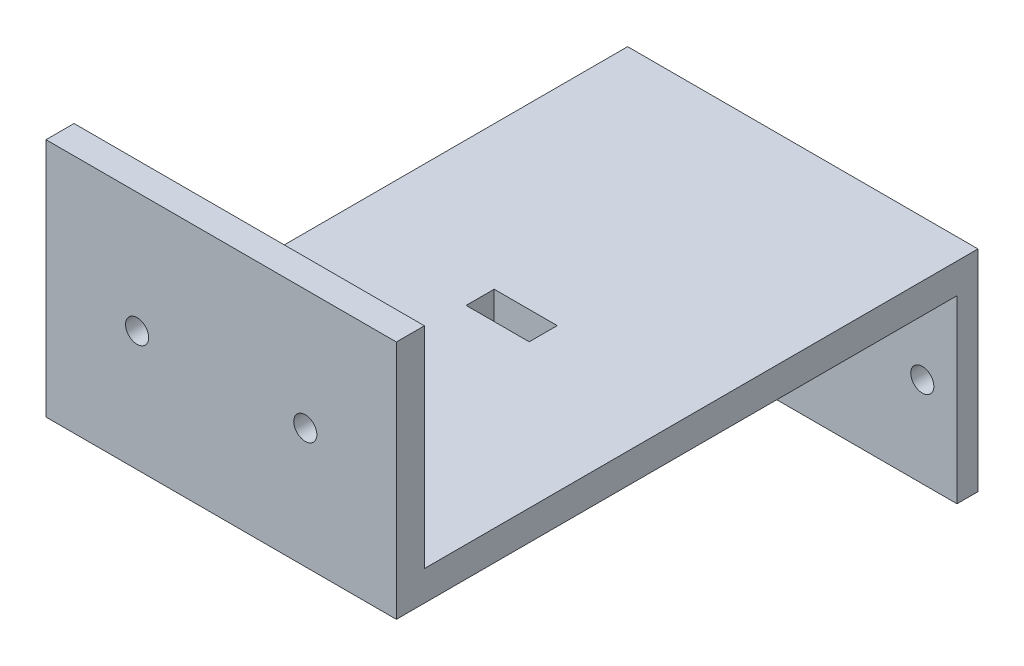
SolidWorks part; units mm, degrees
ref_plane "前视基准面" through (0, 0, 0) normal (0, 0, 1) x (1, 0, 0)
ref_plane "上视基准面" through (0, 0, 0) normal (0, 1, 0) x (1, 0, 0)
ref_plane "右视基准面" through (0, 0, 0) normal (1, 0, 0) x (0, 0, -1)
other "Configuration Table"
sketch "草图1" plane through (0, 0, 0) normal (0, 0, 1) x (1, 0, 0)
  line L0 (0, 0) -> (-50, 0)
  line L1 (-50, 0) -> (-50, 30)
  line L2 (-50, 30) -> (0, 30)
  line L3 (0, 30) -> (0, 0)
  dimension "D1" = 50
  dimension "D2" = 30
extrude "凸台-拉伸1" add sketch "草图1" along normal blind 3
sketch "草图3" plane through (0, 0, 3) normal (0, 0, 1) x (1, 0, 0)
  line L0 (-50, 30) -> (0, 30)
  line L1 (0, 30) -> (-50, 30) construction
  line L2 (-50, 30) -> (-50, 0) construction
  line L3 (0, 30) -> (0, 25.7173)
  line L4 (0, 0) -> (0, 30) construction
  line L5 (0, 25.7173) -> (-50, 25.7173)
  line L6 (-50, 25.7173) -> (-50, 30)
extrude "凸台-拉伸2" add sketch "草图3" along normal blind 80
sketch "草图6" plane through (0, 30, 0) normal (0, 1, 0) x (1, 0, 0)
  line L0 (-50, -83) -> (0, -83)
  line L1 (0, -83) -> (0, -79)
  line L2 (0, -83) -> (0, 0) construction
  line L3 (0, -79) -> (-50, -79)
  line L4 (-50, -83) -> (-50, 0) construction
  line L5 (-50, -79) -> (-50, -83)
  dimension "D1" = 4
extrude "凸台-拉伸3" add sketch "草图6" along normal blind 30
sketch "草图7" plane through (0, 0, 3) normal (0, 0, 1) x (1, 0, 0)
  line L0 (-50, 12.8587) -> (21.8234, 12.8587) construction
  line L1 (-50, 25.7173) -> (-50, 0) construction
  line L2 (-25, 0) -> (-25, 21.1552) construction
  line L3 (-50, 0) -> (0, 0) construction
  circle A0 centre (-45.05, 12.8587) radius 1.65
  circle A1 centre (-4.95, 12.8587) radius 1.65
  dimension "D1" = 40.1
  dimension "D2" = 3.3
extrude "切除-拉伸1" cut sketch "草图7" against normal blind 30
sketch "草图8" plane through (0, 0, 83) normal (0, 0, 1) x (1, 0, 0)
  line L0 (-50, 42.8587) -> (17.1704, 42.8587) construction
  line L2 (-50, 60) -> (-50, 25.7173) construction
  line L4 (-25, 60) -> (-25, 16.5259) construction
  line L5 (-50, 60) -> (0, 60) construction
  circle A2 centre (-37, 42.8587) radius 1.65
  circle A3 centre (-13, 42.8587) radius 1.65
  dimension "D1" = 3.3
  dimension "D2" = 24
extrude "切除-拉伸2" cut sketch "草图8" against normal blind 30
sketch "草图9" plane through (0, 25.7173, 0) normal (0, -1, 0) x (1, 0, 0)
  line L0 (-25.0439, 3) -> (-25.0439, 41.5)
  line L2 (-50, 3) -> (0, 3) construction
  line L4 (-20.5439, 39.5) -> (-29.5439, 39.5)
  line L5 (-20.5439, 39.5) -> (-20.5439, 43.5)
  line L6 (-20.5439, 43.5) -> (-29.5439, 43.5)
  line L7 (-29.5439, 39.5) -> (-29.5439, 43.5)
  line L8 (-20.5439, 39.5) -> (-29.5439, 43.5) construction
  line L9 (-20.5439, 43.5) -> (-29.5439, 39.5) construction
  line L10 (-29.5439, 74.3381) -> (-20.5439, 74.3381)
  line L11 (-29.5439, 74.3381) -> (-29.5439, 70.3381)
  line L12 (-29.5439, 70.3381) -> (-20.5439, 70.3381)
  line L13 (-20.5439, 74.3381) -> (-20.5439, 70.3381)
  line L14 (-29.5439, 74.3381) -> (-20.5439, 70.3381) construction
  line L15 (-29.5439, 70.3381) -> (-20.5439, 74.3381) construction
  point P8 (-25.0439, 72.3381)
  point P13 (-25.0439, 72.3381)
  dimension "D1" = 9
  dimension "D2" = 4
  dimension "D3" = 9
  dimension "D4" = 4
extrude "切除-拉伸3" cut sketch "草图9" against normal blind 10
